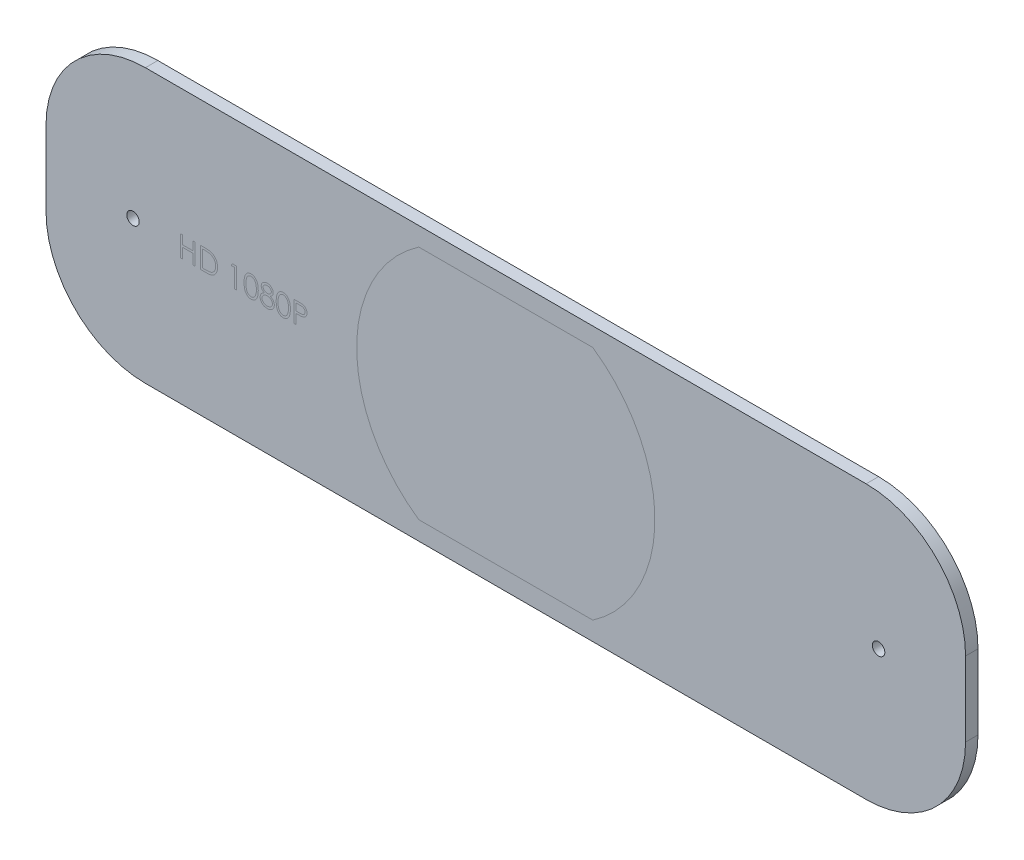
SolidWorks part; units mm, degrees
ref_plane "Front Plane" through (0, 0, 0) normal (0, 0, 1) x (1, 0, 0)
ref_plane "Top Plane" through (0, 0, 0) normal (0, 1, 0) x (1, 0, 0)
ref_plane "Right Plane" through (0, 0, 0) normal (1, 0, 0) x (0, 0, -1)
sketch "Sketch1" plane through (0, 0, 0) normal (0, 0, 1) x (1, 0, 0)
  line L0 (30, 0) -> (-30, 0) construction
  line L1 (-29, 11) -> (29, 11)
  line L2 (-37, 3) -> (-37, -3)
  line L3 (-29, -11) -> (29, -11)
  line L4 (37, 3) -> (37, -3)
  arc A0 (-37, -3) -> (-29, -11) centre (-29, -3) ccw
  arc A1 (29, -11) -> (37, -3) centre (29, -3) ccw
  arc A2 (29, 11) -> (37, 3) centre (29, 3) cw
  arc A3 (-29, 11) -> (-37, 3) centre (-29, 3) ccw
  circle A4 centre (-30, 0) radius 0.5
  circle A5 centre (30, 0) radius 0.5
  point P5 (0, 11)
  point P7 (37, 0)
  point P19 (0, 0)
  dimension "D3" = 8
  dimension "D5" = 1
  dimension "D1" = 74
  dimension "D2" = 22
  dimension "D4" = 60
extrude "Boss-Extrude1" add sketch "Sketch1" along normal mid plane 1
sketch "Sketch3" plane through (0, 0, 0) normal (0, 0, 1) x (1, 0, 0)
  line L0 (0, 9.5) -> (0, -9.5) construction
  line L1 (7, 9.5) -> (-7, 9.5)
  line L2 (-7, -9.5) -> (7, -9.5)
  line L3 (-0.475, 0) -> (0.475, 0) construction
  arc A0 (-7, 9.5) -> (-7, -9.5) centre (-0.475, 0) ccw
  arc A1 (7, 9.5) -> (7, -9.5) centre (0.475, 0) cw
  point P4 (0, 0)
  point P8 (0, 9.5)
  point P11 (0, -9.5)
  point P14 (0, 0)
  dimension "D3" = 24
  dimension "D1" = 14
  dimension "D2" = 19
split "Split1" trim tools "Sketch3" bodies to split 101 resulting bodies 104 105
sketch "Sketch5"
  dimension "D1" = 3.62
  dimension "D2" = 4
  dimension "D3" = 0.84
  dimension "D4" = 0.84
